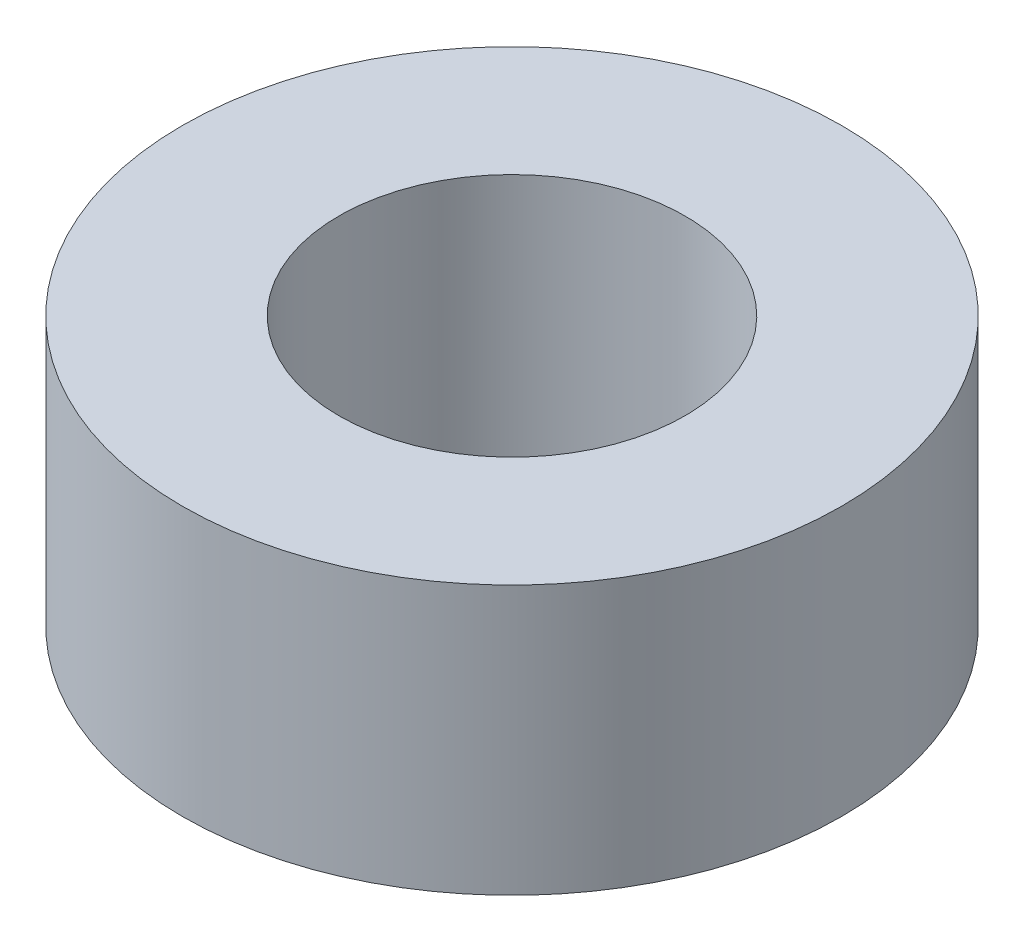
SolidWorks part; units mm, degrees
ref_plane "Front Plane" through (0, 0, 0) normal (0, 0, 1) x (1, 0, 0)
ref_plane "Top Plane" through (0, 0, 0) normal (0, 1, 0) x (1, 0, 0)
ref_plane "Right Plane" through (0, 0, 0) normal (1, 0, 0) x (0, 0, -1)
sketch "Sketch1" plane through (0, 0, 0) normal (0, 1, 0) x (1, 0, 0)
  circle A0 centre (0, 0) radius 2.1
  circle A1 centre (0, 0) radius 4
  dimension "D1" = 4.2
  dimension "D2" = 8
extrude "Boss-Extrude1" add sketch "Sketch1" along normal blind 3.26
